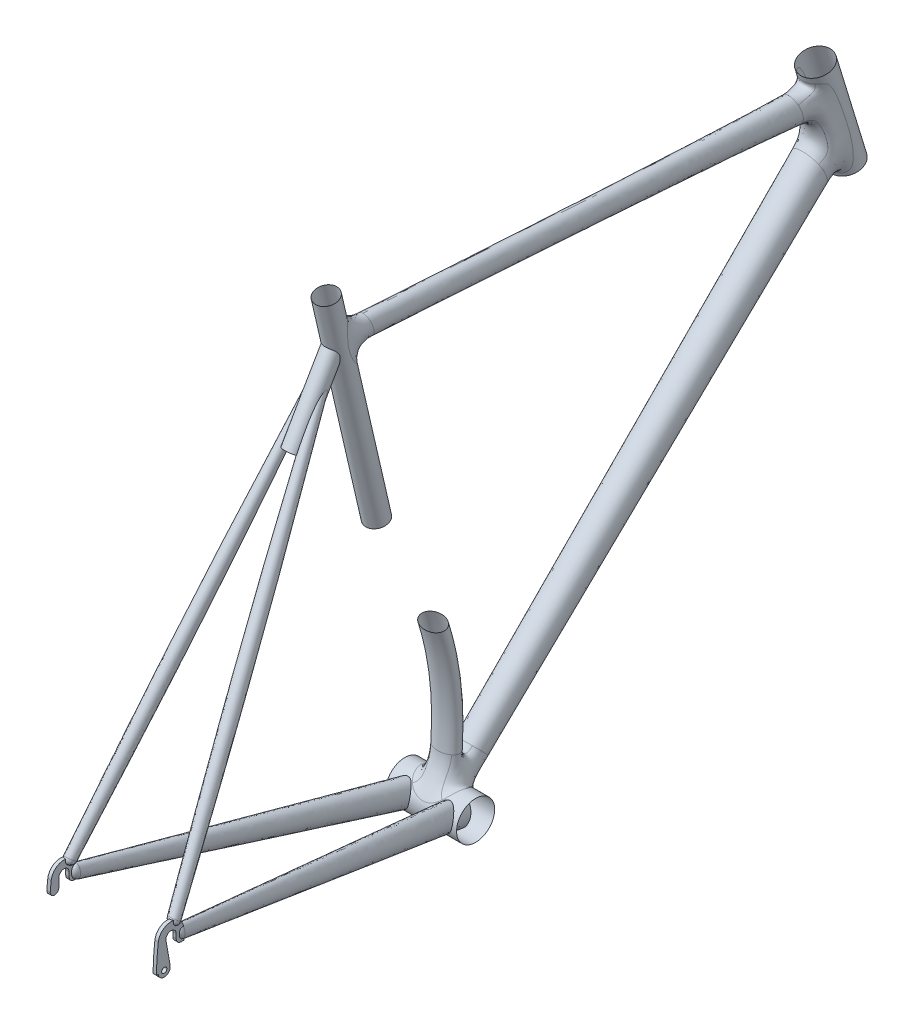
SolidWorks part; units mm, degrees
other "Top Tube"
other "Bottom Bracket"
other "Seat Tube, Lower "
other "Seat Tube, Upper "
other "Down Tube"
other "Head Tube"
other "Dropout, Left"
other "Dropout, Right"
other "Chain Stay, Right"
other "Chain Stay, Left"
other "Seat Stay, Right"
other "Seat Stay, Left"
ref_plane "Front Plane" through (0, 0, 0) normal (0, 0, 1) x (1, 0, 0)
ref_plane "Top Plane" through (0, 0, 0) normal (0, 1, 0) x (1, 0, 0)
ref_plane "Right Plane" through (0, 0, 0) normal (1, 0, 0) x (0, 0, -1)
sketch "Tube Centerlines" plane through (0, 0, 0) normal (1, 0, 0) x (0, 0, -1)
  line L0 (378.0551, 266.7) -> (837.7165, 719.7458)
  line L1 (378.0551, 266.7) -> (435.3368, 463.7667) construction
  line L2 (851.0837, 676.0236) -> (815.4378, 792.6162)
  line L3 (378.0551, 266.7) -> (0, 350)
  line L4 (0, 350) -> (256.6378, 792.6162)
  line L5 (256.6378, 792.6162) -> (826.5771, 756.181)
  line L6 (256.6378, 792.6162) -> (378.0551, 266.7) construction
  line L7 (0, 55) -> (0, -55) construction
  dimension "D1" = 45.72
  dimension "D2" = 38.1
  dimension "D3" = 38.1
  dimension "D4" = 72.32
  dimension "D5" = 116.448
  dimension "D6" = 122.989
  dimension "D7" = 539.75
  dimension "D8" = 17
imported_body "Tube Cap 1"
imported_body "Tube Cap 2"
imported_body "Tube Cap 3"
imported_body "Tube Cap 4"
imported_body "Chain Stay, Left"
imported_body "Seat Stay, Left"
imported_body "Chain Stay, Right"
imported_body "Seat Stay, Right"
imported_body "Seat Stay, Center"
imported_body "Top Tube"
imported_body "Bottom Bracket"
imported_body "Seat Tube, Lower"
imported_body "Seat Tube, Upper"
imported_body "Down Tube"
imported_body "Head Tube"
imported_body "Dropout, Right"
imported_body "Dropout, Left"
surface "Chain Stay, Right Knit"
surface "Chain Stay, Left Knit"
surface "Seat Stay, Right Knit"
surface "Seat Stay, Left Knit"
ref_plane "Plane1" through (0, 368.5924, -107.1393) normal (0, 0.9603, -0.2791) x (1, 0, 0)
sketch "Upper Seat Tube Blend" plane through (0, 0, 0) normal (1, 0, 0) x (0, 0, -1)
  line L0 (269.5687, 821.0693) -> (283.2907, 761.6327) construction
  line L1 (303.7763, 588.437) -> (245.2103, 842.1142) construction
  line L2 (285.8531, 812.7692) -> (294.2886, 776.2314)
  line L4 (256.6378, 792.6162) -> (826.5771, 756.181) construction
  line L5 (256.6378, 792.6162) -> (378.0551, 266.7) construction
  line L6 (259.1346, 787.3581) -> (293.7247, 795.3439) construction
  ellipse E0 centre (276.4297, 791.351) end of major axis (269.5687, 821.0693) minor radius 17.75 (285.8531, 812.7692) -> (294.2886, 776.2314) ccw
  dimension "D1" = 61
  dimension "D2" = 35.5
  dimension "D3" = 19
  dimension "D4" = 33
sketch "Head Tube Blend" plane through (0, 0, 0) normal (1, 0, 0) x (0, 0, -1)
  arc A0 (782.7914, 778.2013) -> (785.9539, 768.5651) centre (627.0633, 721.7563) cw
  arc A1 (796.4719, 717.05) -> (803.6708, 702.9583) centre (634.0743, 625.2026) cw
  arc A2 (785.9539, 768.5651) -> (790.675, 747.6116) centre (627.0633, 721.7563) cw
  arc A3 (790.675, 747.6116) -> (792.0611, 736.3508) centre (627.0633, 721.7563) cw
  arc A4 (803.6708, 702.9583) -> (813.5251, 676.2549) centre (634.0743, 625.2026) cw
  arc A5 (813.5251, 676.2549) -> (816.3144, 665.1709) centre (634.0743, 625.2026) cw
  spline S0 degree 3 poles (791.0459, 779.6038) (795.7312, 780.3476) (800.4165, 781.0915) (804.099, 781.4265) knots 0 0 0 0 0.078134 0.078134 0.078134 0.078134
  spline S1 degree 3 poles (835.129, 674.9911) (832.3021, 673.2012) (824.3083, 669.186) (816.3144, 665.1709) knots 0.926015 0.926015 0.926015 0.926015 1 1 1 1
  spline S2 degree 3 poles (804.099, 781.4265) (810.9979, 782.0541) (819.3231, 775.748) (833.5498, 733.4658) (841.4995, 708.3482) (842.9574, 680.3232) (837.172, 676.2847) (835.129, 674.9911) knots 0.078134 0.078134 0.078134 0.078134 0.166979 0.457547 0.746011 0.872546 0.926015 0.926015 0.926015 0.926015
sketch "Lower Seat Tube Blend" plane through (0, 0, 0) normal (1, 0, 0) x (0, 0, -1)
  line L0 (399.2769, 319.0604) -> (406.245, 311.9906)
  line L1 (353.8646, 319.0555) -> (379.1969, 317.6256)
  line L3 (406.245, 311.9906) -> (422.9164, 295.0757)
  line L4 (422.9164, 295.0757) -> (430.2528, 287.6322)
  line L5 (393.6721, 316.8086) -> (398.9212, 316.5123)
  line L6 (379.1969, 317.6256) -> (393.6721, 316.8086)
  line L7 (378.0551, 266.7) -> (837.7165, 719.7458) construction
sketch "Bottom Bracket Blend" plane through (0, -383.8478, -2695.7663) normal (0, -0.9603, 0.2791) x (1, 0, 0)
  line L2 (0, 2438.9275) -> (0, 2375.4275) construction
  line L3 (0, 2365.4934) -> (0, 3026.0392) construction
  line L5 (-25, 2407.1775) -> (25, 2407.1775) construction
  ellipse E0 centre (0, 2407.1775) end of major axis (0, 2375.4275) minor radius 25 (-17.282, 2430.1197) -> (-17.282, 2384.2354) ccw
  ellipse E1 centre (0, 2407.1775) end of major axis (0, 2438.9275) minor radius 25 (17.282, 2430.1197) -> (-17.282, 2430.1197) ccw
  ellipse E2 centre (0, 2407.1775) end of major axis (0, 2438.9275) minor radius 25 (-17.282, 2384.2354) -> (17.282, 2384.2354) ccw
  ellipse E3 centre (0, 2407.1775) end of major axis (0, 2438.9275) minor radius 25 (17.282, 2384.2354) -> (17.282, 2430.1197) ccw
  dimension "D1" = 50
  dimension "D2" = 63.5
surface "Surface-Trim1"
surface "Surface-Loft1"
surface "Surface-Trim2"
other "Boundary-Surface1"
other "Boundary-Surface2"
other "Boundary-Surface3"
surface "Surface-Fill1"
mirror "Mirror1" about plane through (0, 0, 0) normal (1, 0, 0)
surface "Surface-Knit1"
surface "Surface-Trim3"
wrap "Wrap1" sketch "Bottom Bracket Blend" wrap type scribe source sketch "Bottom Bracket Blend"
other "DeleteFace1"
surface "Surface-Loft2"
surface "Surface-Loft3"
surface "Surface-Loft4"
surface "Surface-Fill2"
surface "Surface-Fill3"
surface "Surface-Knit2"
sketch "Seat Stay Blend " plane through (0, 0, 0) normal (1, 0, 0) x (0, 0, -1)
  line L0 (216.1796, 768.997) -> (250.7204, 741.8761)
  ellipse E0 centre (237.7358, 772.3537) end of major axis (224.5435, 802.7431) minor radius 21.4077 (216.1796, 768.997) -> (250.7204, 741.8761) cw
